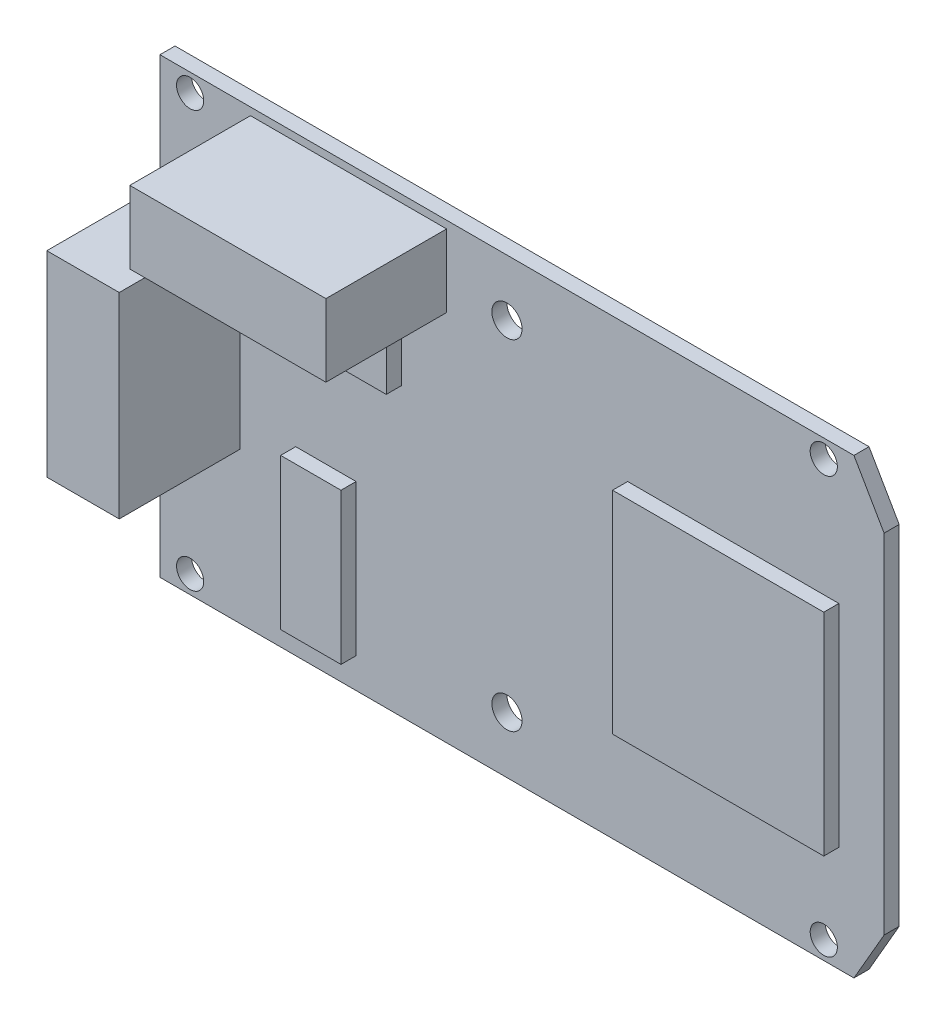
SolidWorks part; units mm, degrees
ref_plane "Plan de face" through (0, 0, 0) normal (0, 0, 1) x (1, 0, 0)
ref_plane "Plan de dessus" through (0, 0, 0) normal (0, 1, 0) x (1, 0, 0)
ref_plane "Plan de droite" through (0, 0, 0) normal (1, 0, 0) x (0, 0, -1)
sketch "Esquisse1" plane through (0, 0, 0) normal (0, 0, 1) x (1, 0, 0)
  line L0 (0, 0) -> (28.3323, 0) construction
  line L1 (-24, 15) -> (24, 15)
  line L2 (-24, 15) -> (-24, -15)
  line L3 (-24, -15) -> (24, -15)
  line L4 (24, 15) -> (24, -15)
  line L5 (0, 0) -> (0, 19.7026) construction
  dimension "D1" = 48
  dimension "D2" = 30
extrude "Extrusion1" add sketch "Esquisse1" along normal blind 1
sketch "Esquisse2" plane through (0, 0, 1) normal (0, 0, 1) x (1, 0, 0)
  line L0 (24, -15) -> (24, 15) construction
  line L1 (7, 6) -> (21, 6)
  line L2 (7, 6) -> (7, -8)
  line L3 (7, -8) -> (21, -8)
  line L4 (21, 6) -> (21, -8)
  line L5 (-24, -15) -> (24, -15) construction
  line L6 (-24, 15) -> (-24, -15) construction
  line L7 (-15, -3) -> (-11, -3)
  line L8 (-15, -3) -> (-15, -13)
  line L9 (-15, -13) -> (-11, -13)
  line L10 (-11, -3) -> (-11, -13)
  line L12 (-18, 8) -> (-8, 8)
  line L13 (-18, 8) -> (-18, 4)
  line L14 (-18, 4) -> (-8, 4)
  line L15 (-8, 8) -> (-8, 4)
  dimension "D1" = 14
  dimension "D2" = 3
  dimension "D3" = 7
  dimension "D4" = 4
  dimension "D5" = 10
  dimension "D6" = 2
  dimension "D7" = 9
  dimension "D8" = 15
  dimension "D9" = 7
extrude "Extrusion2" add sketch "Esquisse2" along normal blind 1
sketch "Esquisse3" plane through (0, 0, 1) normal (0, 0, 1) x (1, 0, 0)
  line L0 (-24, 15) -> (-24, -15) construction
  line L1 (-23.5, 8) -> (-18.7, 8)
  line L2 (-23.5, 8) -> (-23.5, -5)
  line L3 (-23.5, -5) -> (-18.7, -5)
  line L4 (-18.7, 8) -> (-18.7, -5)
  line L5 (-18, 14.5) -> (-5, 14.5)
  line L6 (-18, 14.5) -> (-18, 9.7)
  line L7 (-18, 9.7) -> (-5, 9.7)
  line L8 (-5, 14.5) -> (-5, 9.7)
  line L9 (24, 15) -> (-24, 15) construction
  line L10 (-18, 8) -> (-18, 4) construction
  dimension "D1" = 13
  dimension "D2" = 4.8
  dimension "D3" = 0.5
  dimension "D4" = 7
  dimension "D5" = 0.5
extrude "Extrusion3" add sketch "Esquisse3" along normal blind 8
sketch "Esquisse4" plane through (0, 0, 0) normal (0, 0, -1) x (-1, 0, 0)
  line L1 (-14.5, -10) -> (-1.5, -10)
  line L2 (-14.5, -10) -> (-14.5, -14.8)
  line L3 (-14.5, -14.8) -> (-1.5, -14.8)
  line L4 (-1.5, -10) -> (-1.5, -14.8)
  line L5 (-24, -15) -> (-24, 15) construction
  line L6 (24, -15) -> (-24, -15) construction
  dimension "D1" = 4.8
  dimension "D2" = 13
  dimension "D3" = 9.5
  dimension "D4" = 0.2
extrude "Extrusion4" add sketch "Esquisse4" along normal blind 8
sketch "Esquisse5" plane through (0, 0, 0) normal (0, 0, -1) x (-1, 0, 0)
  line L0 (24, -15) -> (-24, -15) construction
  line L1 (13, 7) -> (17, 7)
  line L2 (13, 7) -> (13, -3)
  line L3 (13, -3) -> (17, -3)
  line L4 (17, 7) -> (17, -3)
  line L5 (24, 15) -> (24, -15) construction
  line L7 (-5, 5) -> (6, 5)
  line L8 (-5, 5) -> (-5, -6)
  line L9 (-5, -6) -> (6, -6)
  line L10 (6, 5) -> (6, -6)
  dimension "D1" = 4
  dimension "D2" = 10
  dimension "D3" = 12
  dimension "D4" = 7
  dimension "D5" = 11
  dimension "D6" = 7
  dimension "D7" = 9
extrude "Extrusion5" add sketch "Esquisse5" along normal blind 1
sketch "Esquisse6" plane through (0, 0, 1) normal (0, 0, 1) x (1, 0, 0)
  line L0 (0, 0) -> (-7.3186, 0) construction
  line L1 (-24, 15) -> (-24, -15) construction
  circle A0 centre (-1, -11.25) radius 1
  circle A1 centre (-1, 11.25) radius 1
  dimension "D1" = 2
  dimension "D3" = 22.5
  dimension "D2" = 23
extrude "Enlèv. mat.-Extru.1" cut sketch "Esquisse6" against normal up to next
chamfer "Chanfrein1" distance 2 angle 60 1 edges at (24, 15, 0.5)
chamfer "Chanfrein2" distance 2 angle 60 1 edges at (24, -15, 0.5)
sketch "Esquisse7" plane through (0, 0, 1) normal (0, 0, 1) x (1, 0, 0)
  circle A0 centre (-22, 13.8) radius 0.9
  circle A1 centre (-22, -13.8) radius 0.9
  circle A2 centre (20, 13.8) radius 0.9
  circle A3 centre (20, -13.8) radius 0.9
  dimension "D1" = 1.8
extrude "Enlèv. mat.-Extru.2" cut sketch "Esquisse7" against normal up to next
